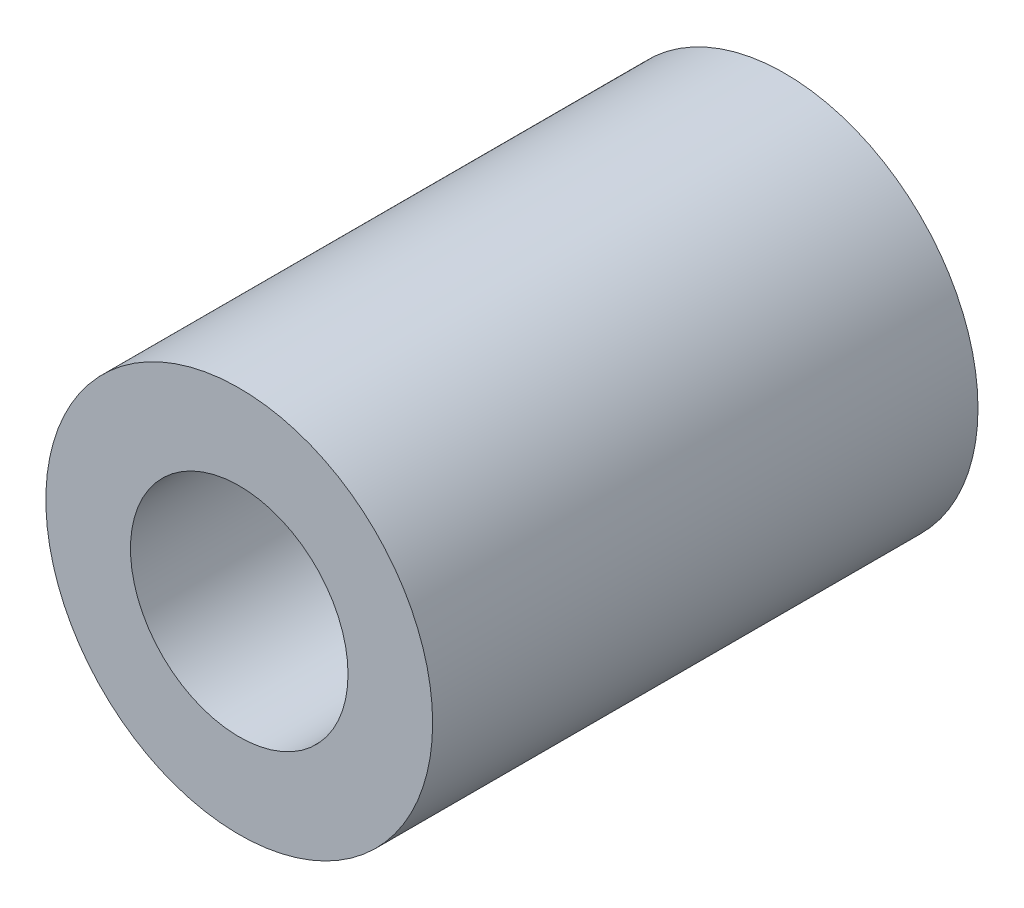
SolidWorks part; units mm, degrees
ref_plane "Front Plane" through (0, 0, 0) normal (0, 0, 1) x (1, 0, 0)
ref_plane "Top Plane" through (0, 0, 0) normal (0, 1, 0) x (1, 0, 0)
ref_plane "Right Plane" through (0, 0, 0) normal (1, 0, 0) x (0, 0, -1)
sketch "Sketch1" plane through (0, 0, 0) normal (0, 0, 1) x (1, 0, 0)
  circle A0 centre (0, 0) radius 1.7859
  circle A1 centre (0, 0) radius 3.175
  dimension "D1" = 3.5719
  dimension "D2" = 6.35
extrude "Boss-Extrude1" add sketch "Sketch1" along normal mid plane 8.9535
